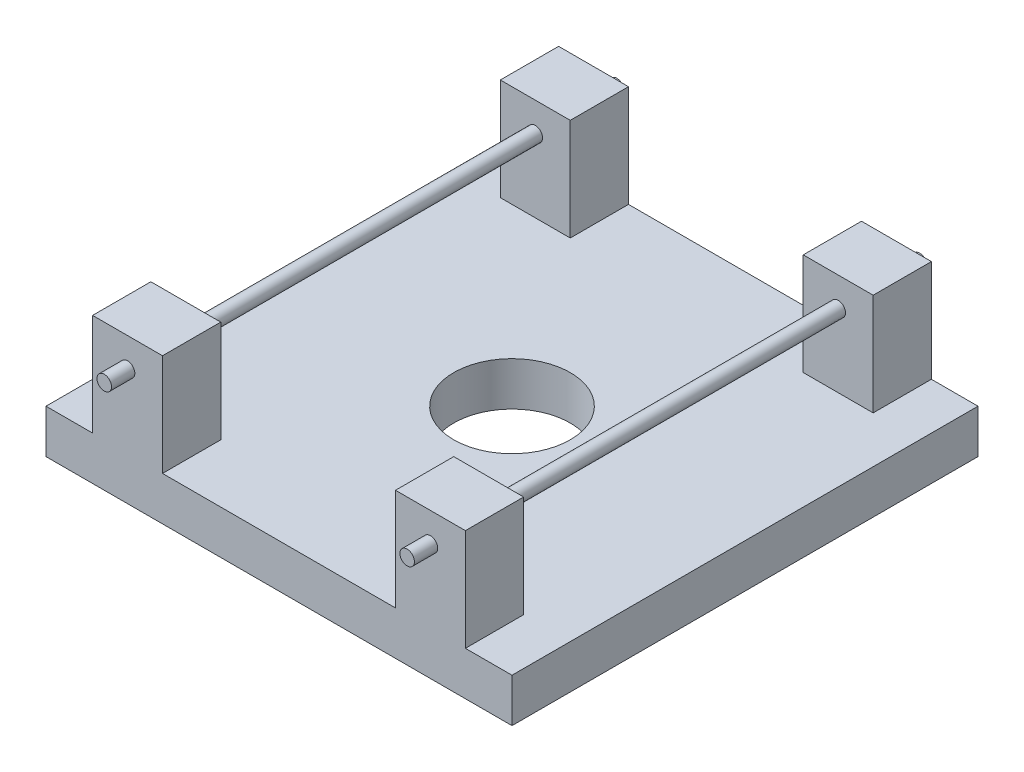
SolidWorks part; units mm, degrees
ref_plane "Front Plane" through (0, 0, 0) normal (0, 0, 1) x (1, 0, 0)
ref_plane "Top Plane" through (0, 0, 0) normal (0, 1, 0) x (1, 0, 0)
ref_plane "Right Plane" through (0, 0, 0) normal (1, 0, 0) x (0, 0, -1)
sketch "Sketch3" plane through (0, 0, 0) normal (0, 1, 0) x (1, 0, 0)
  line L1 (-25.4, 25.4) -> (25.4, 25.4)
  line L2 (-25.4, 25.4) -> (-25.4, -25.4)
  line L3 (-25.4, -25.4) -> (25.4, -25.4)
  line L4 (25.4, 25.4) -> (25.4, -25.4)
  line L5 (-25.4, 25.4) -> (25.4, -25.4) construction
  line L6 (-25.4, -25.4) -> (25.4, 25.4) construction
  point P0 (0, 0)
  dimension "D1" = 50.8
  dimension "D2" = 50.8
extrude "Boss-Extrude2" add sketch "Sketch3" along normal blind 4.7625
sketch "Sketch4" plane through (0, 4.7625, 0) normal (0, 1, 0) x (1, 0, 0)
  circle A0 centre (0, 0) radius 6.35
extrude "Cut-Extrude2" cut sketch "Sketch4" against normal through all
sketch "Sketch5" plane through (0, 4.7625, 0) normal (0, 1, 0) x (1, 0, 0)
  line L0 (25.4, 25.4) -> (-25.4, 25.4) construction
  line L1 (-20.32, 25.4) -> (-12.7, 25.4)
  line L2 (-20.32, 25.4) -> (-20.32, -25.4)
  line L3 (-20.32, -25.4) -> (-12.7, -25.4)
  line L4 (-12.7, 25.4) -> (-12.7, -25.4)
  line L9 (0, 0) -> (0, 19.1256) construction
  line L10 (20.32, -25.4) -> (12.7, -25.4)
  line L11 (20.32, 25.4) -> (12.7, 25.4)
  line L12 (20.32, 25.4) -> (20.32, -25.4)
  line L13 (12.7, 25.4) -> (12.7, -25.4)
  dimension "D1" = 50.8
  dimension "D2" = 7.62
  dimension "D3" = 12.7
extrude "Boss-Extrude3" add sketch "Sketch5" along normal blind 11.1125
sketch "Sketch6" plane through (0, 15.875, 0) normal (0, 1, 0) x (1, 0, 0)
  line L0 (0, 0) -> (0, 12.0892) construction
  line L1 (-20.32, 25.4) -> (-20.32, -25.4) construction
  line L2 (-20.32, 19.05) -> (-12.7, 19.05)
  line L3 (-20.32, 19.05) -> (-20.32, -19.05)
  line L4 (-20.32, -19.05) -> (-12.7, -19.05)
  line L5 (-12.7, 19.05) -> (-12.7, -19.05)
  line L6 (-12.7, -25.4) -> (-12.7, 25.4) construction
  line L7 (-12.7, 25.4) -> (-20.32, 25.4) construction
  line L8 (-20.32, -25.4) -> (-12.7, -25.4) construction
  line L9 (20.32, -19.05) -> (12.7, -19.05)
  line L10 (12.7, 19.05) -> (12.7, -19.05)
  line L11 (20.32, 19.05) -> (20.32, -19.05)
  line L12 (20.32, 19.05) -> (12.7, 19.05)
  dimension "D1" = 6.35
  dimension "D2" = 6.35
extrude "Cut-Extrude3" cut sketch "Sketch6" against normal up to surface (11.1125 mm away) contours L11 L12 L10 L9 | L3 L2 L5 L4
sketch "Sketch7" plane through (0, 0, 25.4) normal (0, 0, 1) x (1, 0, 0)
  line L0 (-20.32, 15.875) -> (-12.7, 15.875) construction
  line L1 (-20.32, 15.875) -> (-20.32, 4.7625) construction
  line L2 (12.7, 15.875) -> (20.32, 15.875) construction
  line L3 (12.7, 15.875) -> (12.7, 4.7625) construction
  circle A0 centre (-16.51, 12.7) radius 0.7937
  circle A1 centre (16.51, 12.7) radius 0.7937
  dimension "D1" = 1.5875
  dimension "D2" = 3.175
  dimension "D3" = 3.81
  dimension "D4" = 3.175
  dimension "D5" = 3.81
extrude "Boss-Extrude4" add sketch "Sketch7" along normal blind 2.54 and the other way blind 53.34
